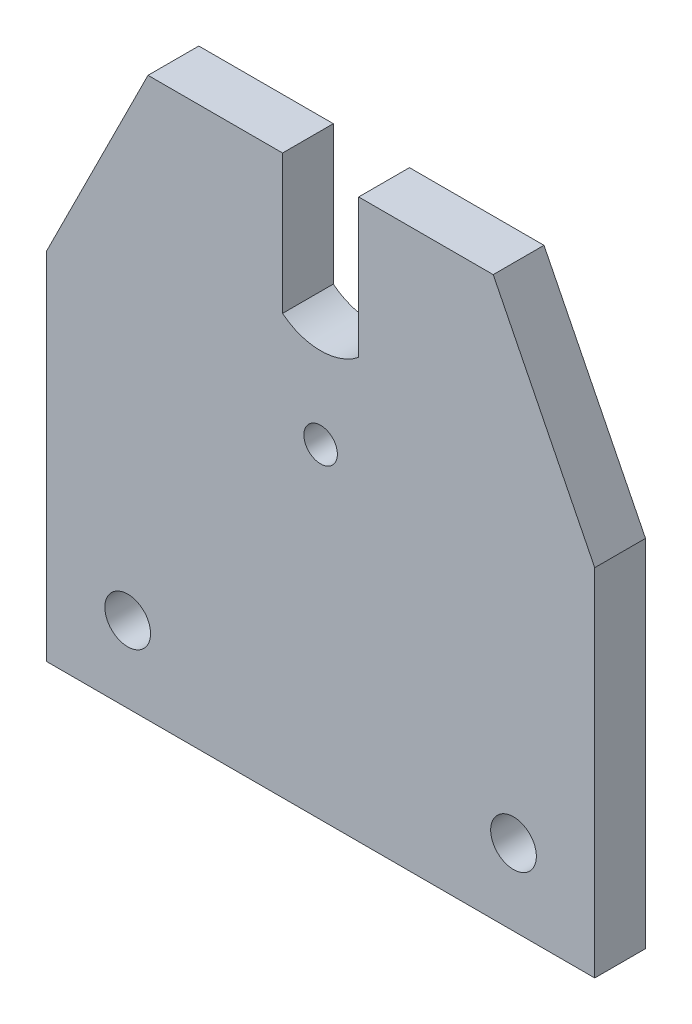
SolidWorks part; units mm, degrees
ref_plane "前视基准面" through (0, 0, 0) normal (0, 0, 1) x (1, 0, 0)
ref_plane "上视基准面" through (0, 0, 0) normal (0, 1, 0) x (1, 0, 0)
ref_plane "右视基准面" through (0, 0, 0) normal (1, 0, 0) x (0, 0, -1)
sketch "草图1" plane through (0, 0, 0) normal (0, 0, 1) x (1, 0, 0)
  line L0 (0, 0) -> (54, 0)
  line L1 (10, 55) -> (23.25, 55)
  line L2 (0, 0) -> (0, 35)
  line L3 (54, 0) -> (54, 35)
  line L4 (23.25, 41.3163) -> (23.25, 55)
  line L5 (30.75, 41.3163) -> (30.75, 55)
  line L6 (30.75, 55) -> (44, 55)
  line L7 (54, 35) -> (44, 55)
  line L8 (10, 55) -> (0, 35)
  arc A0 (23.25, 41.3163) -> (30.75, 41.3163) centre (27, 46) ccw
  circle A1 centre (8, 7.5) radius 2.25
  circle A2 centre (46, 7.5) radius 2.25
  circle A3 centre (27, 32) radius 1.65
extrude "凸台-拉伸1" add sketch "草图1" along normal blind 5
